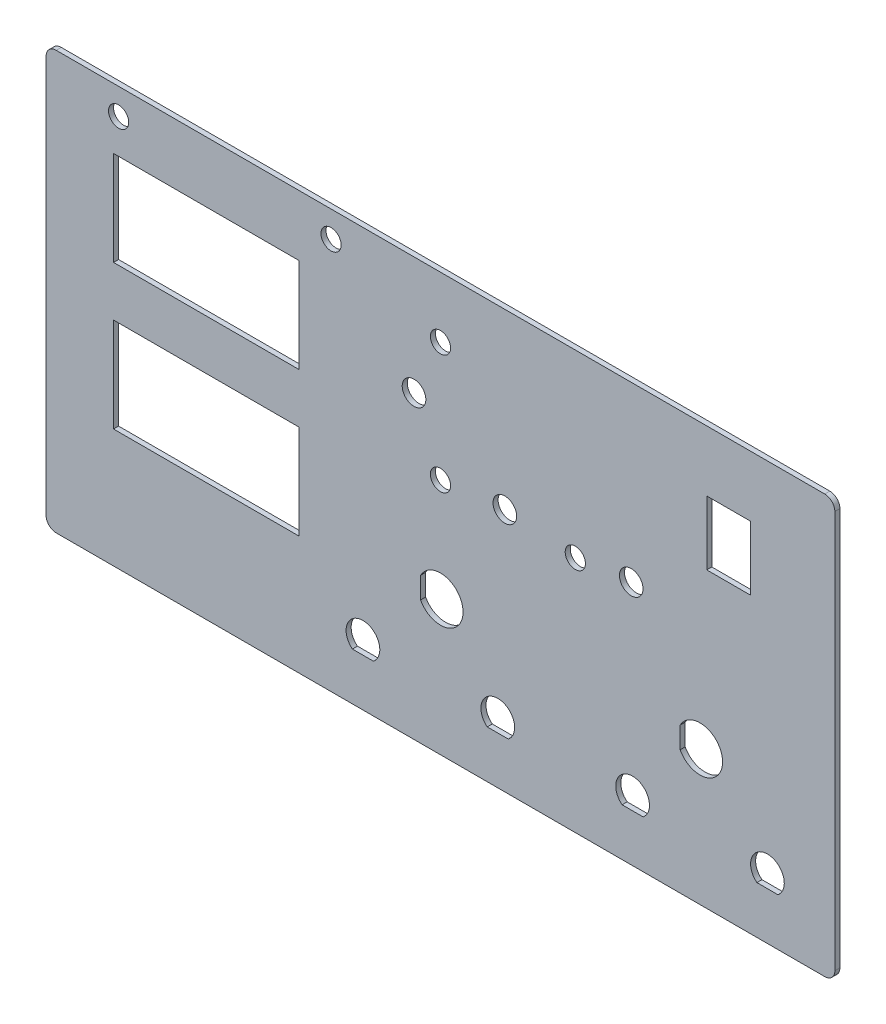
SolidWorks part; units mm, degrees
ref_plane "Přední rovina" through (0, 0, 0) normal (0, 0, 1) x (1, 0, 0)
ref_plane "Horní rovina" through (0, 0, 0) normal (0, 1, 0) x (1, 0, 0)
ref_plane "Pravá rovina" through (0, 0, 0) normal (1, 0, 0) x (0, 0, -1)
sketch "Skica1" plane through (0, 0, 0) normal (0, 0, 1) x (1, 0, 0)
  line L0 (40, 70.6) -> (0, 70.6) construction
  line L1 (-114, 124) -> (114, 124)
  line L2 (-117, 121) -> (-117, 3)
  line L3 (-114, 0) -> (114, 0)
  line L4 (117, 121) -> (117, 3)
  line L5 (-97, 106) -> (-42, 106)
  line L6 (-97, 106) -> (-97, 78)
  line L7 (-97, 78) -> (-42, 78)
  line L8 (-42, 106) -> (-42, 78)
  line L9 (-97, 63.2) -> (-42, 63.2)
  line L10 (-97, 63.2) -> (-97, 35.2)
  line L11 (-97, 35.2) -> (-42, 35.2)
  line L12 (-42, 63.2) -> (-42, 35.2)
  line L13 (79, 106) -> (92, 106)
  line L14 (79, 106) -> (79, 87)
  line L15 (79, 87) -> (92, 87)
  line L16 (92, 106) -> (92, 87)
  line L17 (-110.1513, 70.6) -> (-0.2875, 70.6) construction
  line L18 (-50.4, 39.35) -> (-50.4, 59.05) construction
  line L19 (71.1, 43.1749) -> (71.1, 36.8251)
  line L20 (117, 40) -> (-42.0583, 40) construction
  line L21 (-23, 18) -> (17, 18) construction
  line L22 (-69.5, 101.85) -> (-69.5, 106) construction
  line L23 (-88.6, 101.85) -> (-50.4, 101.85) construction
  line L24 (-88.6, 101.85) -> (-88.6, 82.15) construction
  line L25 (-88.6, 82.15) -> (-50.4, 82.15) construction
  line L26 (-50.4, 101.85) -> (-50.4, 82.15) construction
  line L27 (-88.6, 59.05) -> (-50.4, 59.05) construction
  line L28 (-88.6, 39.35) -> (-88.6, 59.05) construction
  line L29 (-88.6, 39.35) -> (-50.4, 39.35) construction
  line L30 (-88.6, 92) -> (-97, 92) construction
  line L31 (0, 70.6) -> (0, 106) construction
  line L32 (77, 18) -> (77, 45.4254) construction
  line L33 (0, 18) -> (0, 4.9748) construction
  line L34 (57, 18) -> (97, 18) construction
  line L35 (73.0306, 18) -> (73.0306, -1.4308) construction
  line L36 (-19.8711, 14.1) -> (-26.1289, 14.1)
  line L37 (-5.9, 43.1749) -> (-5.9, 36.8251)
  line L38 (0, 18) -> (0, 50.0164) construction
  line L39 (57, 18) -> (22.017, 18) construction
  line L40 (22.017, 18) -> (39.5085, 18) construction
  line L41 (39.5085, 18) -> (39.5085, 50.0164) construction
  line L42 (13.8711, 14.1) -> (20.1289, 14.1)
  line L43 (53.8711, 14.1) -> (60.1289, 14.1)
  line L44 (93.8711, 14.1) -> (100.1289, 14.1)
  arc A0 (71.1, 36.8251) -> (71.1, 43.1749) centre (77, 40) ccw
  circle A1 centre (0, 70.6) radius 3
  circle A2 centre (40, 70.6) radius 3
  arc A3 (13.8711, 14.1) -> (20.1289, 14.1) centre (17, 18) cw
  arc A4 (53.8711, 14.1) -> (60.1289, 14.1) centre (57, 18) cw
  circle A5 centre (0, 106) radius 3
  arc A6 (-114, 124) -> (-117, 121) centre (-114, 121) ccw
  arc A7 (-117, 3) -> (-114, 0) centre (-114, 3) ccw
  arc A8 (114, 0) -> (117, 3) centre (114, 3) ccw
  arc A9 (114, 124) -> (117, 121) centre (114, 121) cw
  arc A10 (93.8711, 14.1) -> (100.1289, 14.1) centre (97, 18) cw
  arc A12 (-26.1289, 14.1) -> (-19.8711, 14.1) centre (-23, 18) cw
  arc A13 (-5.9, 36.8251) -> (-5.9, 43.1749) centre (0, 40) ccw
  point P24 (83.7, 40)
  point P39 (-117, 124)
  point P42 (-117, 0)
  point P45 (117, 0)
  point P75 (46.15, 40)
  point P79 (6.7, 40)
  dimension "D10" = 6.7
  dimension "D12" = 6
  dimension "D15" = 5
  dimension "D19" = 6
  dimension "D20" = 3
  dimension "D23" = 40
  dimension "D28" = 3.9
  dimension "D14" = 6
  dimension "D27" = 3.9
  dimension "D29" = 5
  dimension "D30" = 5
  dimension "D32" = 5
  dimension "D1" = 234
  dimension "D2" = 124
  dimension "D3" = 28
  dimension "D4" = 55
  dimension "D5" = 13
  dimension "D6" = 19
  dimension "D7" = 25
  dimension "D8" = 20
  dimension "D9" = 20
  dimension "D11" = 12.6
  dimension "D13" = 18
  dimension "D16" = 18
  dimension "D17" = 3.9
  dimension "D18" = 40
  dimension "D21" = 40
  dimension "D22" = 40
  dimension "D24" = 38.2
  dimension "D25" = 19.7
  dimension "D26" = 23.1
  dimension "pokus" = 40
  dimension "D31" = 3.9
extrude "Přidat vysunutím1" add sketch "Skica1" along normal blind 1.5
sketch "Skica2" plane through (0, 0, 0) normal (0, 0, -1) x (-1, 0, 0)
  line L0 (117, 121) -> (117, 3) construction
  line L1 (100.4947, 28.2347) -> (100.4947, 21.2347)
  line L2 (98.61, 36.45) -> (108.61, 36.45)
  line L3 (98.61, 36.45) -> (98.61, 105.05)
  line L4 (98.61, 105.05) -> (108.61, 105.05)
  line L5 (100.4947, 21.2347) -> (90.4947, 21.2347)
  line L8 (90.4947, 21.2347) -> (90.4947, 28.2347)
  line L9 (36.6462, 26.3904) -> (36.6462, 18.3904)
  line L12 (36.6462, 18.3904) -> (46.6462, 18.3904)
  line L13 (108.61, 36.45) -> (108.61, 105.05)
  line L14 (40.39, 36.45) -> (30.39, 36.45)
  line L15 (40.39, 36.45) -> (40.39, 105.05)
  line L16 (40.39, 105.05) -> (30.39, 105.05)
  line L18 (117, 121) -> (117, 3) construction
  line L19 (114, 0) -> (-114, 0) construction
  line L20 (46.6462, 18.3904) -> (46.6462, 26.3904)
  line L21 (46.6462, 26.3904) -> (36.6462, 26.3904)
  line L23 (30.39, 36.45) -> (30.39, 105.05)
  dimension "D13" = 16.5053
  dimension "D14" = 21.2347
  dimension "D15" = 68.6
  dimension "D16" = 10
  dimension "D17" = 10
  dimension "D18" = 68.6
  dimension "D19" = 8.39
  dimension "D20" = 76.61
  dimension "D21" = 10
sketch "Skica3" plane through (0, 0, 1.5) normal (0, 0, 1) x (1, 0, 0)
  circle A0 centre (-95.4817, 116.2361) radius 3
  circle A1 centre (-32.4642, 116.2184) radius 3
  circle A2 centre (-7.8462, 89.0804) radius 3.5
  circle A3 centre (19.0952, 72.5477) radius 3.5
  circle A4 centre (56.5951, 72.6415) radius 3.5
extrude "Odebrat vysunutím1" cut sketch "Skica3" against normal up to next
